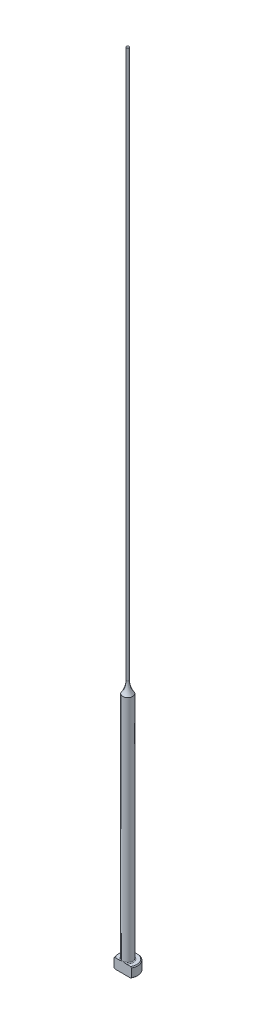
SolidWorks part; units mm, degrees
ref_plane "Front Plane" through (0, 0, 0) normal (0, 0, 1) x (1, 0, 0)
ref_plane "Top Plane" through (0, 0, 0) normal (0, 1, 0) x (1, 0, 0)
ref_plane "Right Plane" through (0, 0, 0) normal (1, 0, 0) x (0, 0, -1)
sketch "Sketch1" plane through (0, 0, 0) normal (0, 0, 1) x (1, 0, 0)
  line L0 (0, 259.9588) -> (0, -15.1925) construction
  line L1 (0, 0) -> (-3.175, 0)
  line L2 (-3.175, 0) -> (-3.175, 3.175)
  line L3 (-3.175, 3.175) -> (-1.5875, 3.175)
  line L4 (-0.3962, 79.9027) -> (-0.3962, 254)
  line L5 (-0.3962, 254) -> (0, 254)
  line L6 (0, 254) -> (0, 0)
  line L7 (-1.5875, 3.175) -> (-1.5875, 76.2)
  arc A0 (-1.5875, 76.2) -> (-0.3962, 79.9027) centre (-6.7462, 79.9027) ccw
  point P13 (-1.5875, 0)
  dimension "D1" = 6.35
  dimension "L" = 254
  dimension "D2" = 3.175
  dimension "H" = 6.35
  dimension "T" = 3.175
  dimension "D" = 0.7925
  dimension "S" = 76.2
revolve "Revolve1" add sketch "Sketch1" angle 360 about L0
chamfer "Chamfer1" distance 0.254 angle 45 2 edges at (0, 3.175, 3.175) (0, 0, 3.175)
fillet "Fillet1" radius 0.254 1 edges at (0, 3.175, 1.5875)
sketch "Sketch2" plane through (0, 0, 0) normal (0, -1, 0) x (1, 0, 0)
  line L0 (-2.7496, 1.5875) -> (2.7496, 1.5875)
  circle A0 centre (0, 0) radius 3.175 construction
  arc A1 (2.7496, 1.5875) -> (-2.7496, 1.5875) centre (0, 0) ccw
  circle A4 centre (0, 0) radius 1.5875 construction
  dimension "D1" = 0
extrude "KEY" cut sketch "Sketch2" against normal through all
